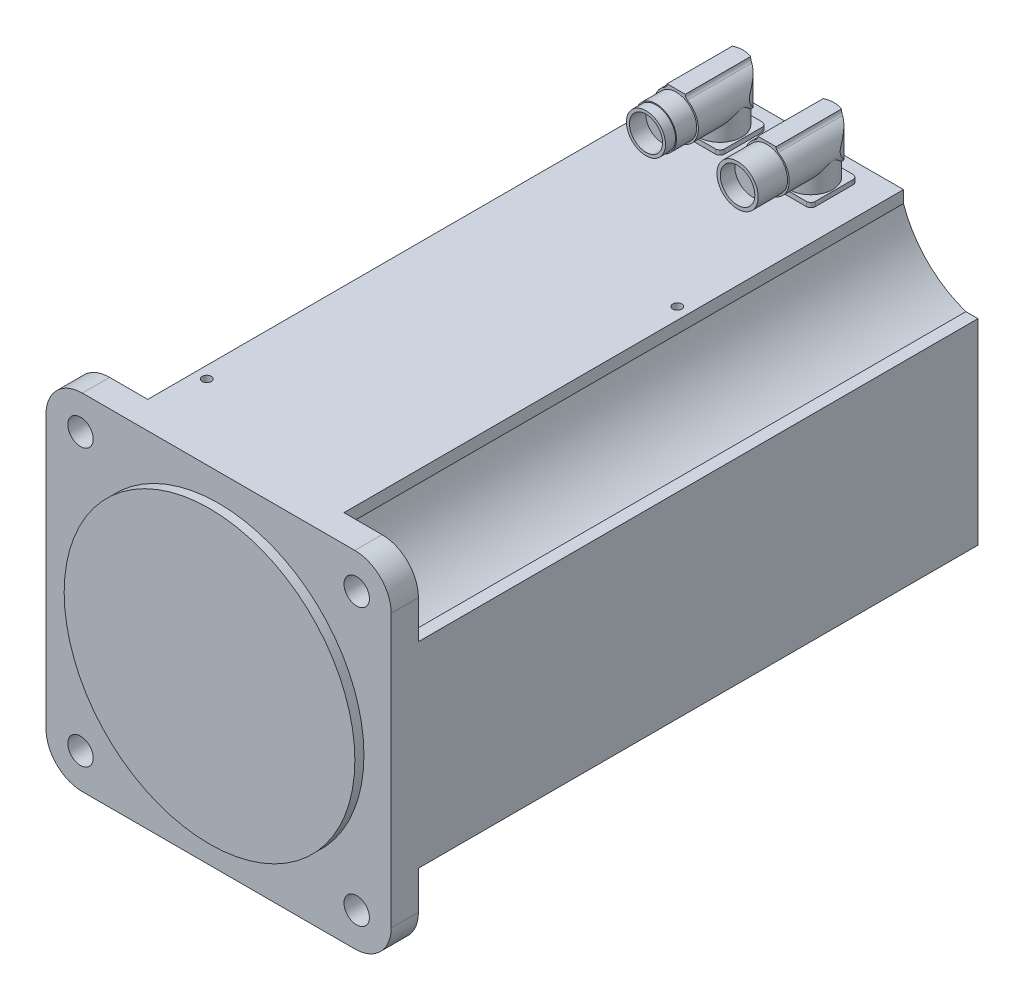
SolidWorks part; units mm, degrees
ref_plane "Piano1 (Front/Back)" through (0, 0, 0) normal (0, 0, 1) x (1, 0, 0)
ref_plane "Piano2 (Top/Bottom)" through (0, 0, 0) normal (0, 1, 0) x (1, 0, 0)
ref_plane "Piano3 (Left/Right)" through (0, 0, 0) normal (1, 0, 0) x (0, 0, -1)
imported_body "Importato1"
hole_wizard "M6 Foro filettato profondo1" positions "Schizzo2" profile "Schizzo1" tap size "M6" standard "ISO"
sketch "Schizzo2" plane through (0, 95, 0) normal (0, 1, 0) x (-1, 0, 0)
  line L0 (80, 15.75) -> (-80, 15.75) construction
  point P0 (47.5, -25.25)
  point P1 (-47.5, -189.25)
  dimension "D1" = 41
  dimension "D2" = 205
  dimension "D3" = 47.5
  dimension "D4" = 47.5
sketch "Schizzo1" plane through (-47.5, 95, -25.25) normal (1, 0, 0) x (0, 0, 1)
  line L0 (0, 0) -> (0, 18.5022)
  line L1 (0, 18.5022) -> (2.5, 17)
  line L2 (2.5, 17) -> (2.5, 0)
  line L5 (2.5, 0) -> (0, 0)
  line L10 (0, 18.5022) -> (-2.5, 17) construction
  line L11 (0, -6.35) -> (0, 107.95) construction
  dimension "Tap Drill Dia." = 5
  dimension "Tap Drill Depth" = 17
  dimension "Drill Angle" = 118
